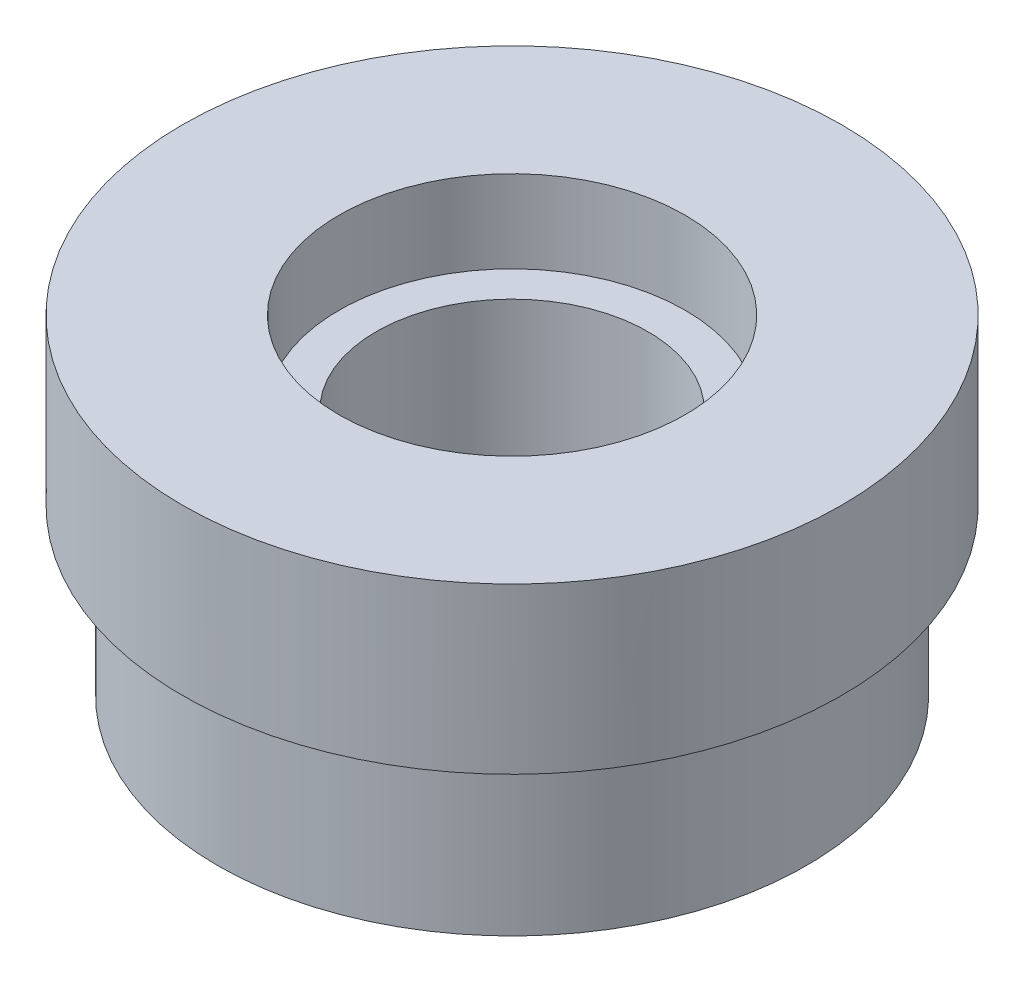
SolidWorks part; units mm, degrees
ref_plane "Front Plane" through (0, 0, 0) normal (0, 0, 1) x (1, 0, 0)
ref_plane "Top Plane" through (0, 0, 0) normal (0, 1, 0) x (1, 0, 0)
ref_plane "Right Plane" through (0, 0, 0) normal (1, 0, 0) x (0, 0, -1)
sketch "Sketch1" plane through (0, 0, 0) normal (0, 1, 0) x (1, 0, 0)
  circle A0 centre (0, 0) radius 40
  circle A1 centre (0, 0) radius 16.5
  dimension "D1" = 80
  dimension "D2" = 33
extrude "Extrude1" add sketch "Sketch1" along normal blind 40
sketch "Sketch2" plane through (0, 40, 0) normal (0, 1, 0) x (1, 0, 0)
  circle A0 centre (0, 0) radius 21
  dimension "D1" = 42
extrude "Extrude3" cut sketch "Sketch2" against normal blind 10
sketch "Sketch7" plane through (0, 0, 0) normal (0, -1, 0) x (1, 0, 0)
  circle A0 centre (0, 0) radius 35.75
  dimension "D1" = 71.5
extrude "Extrude4" cut sketch "Sketch7" against normal blind 20 flip side to cut
